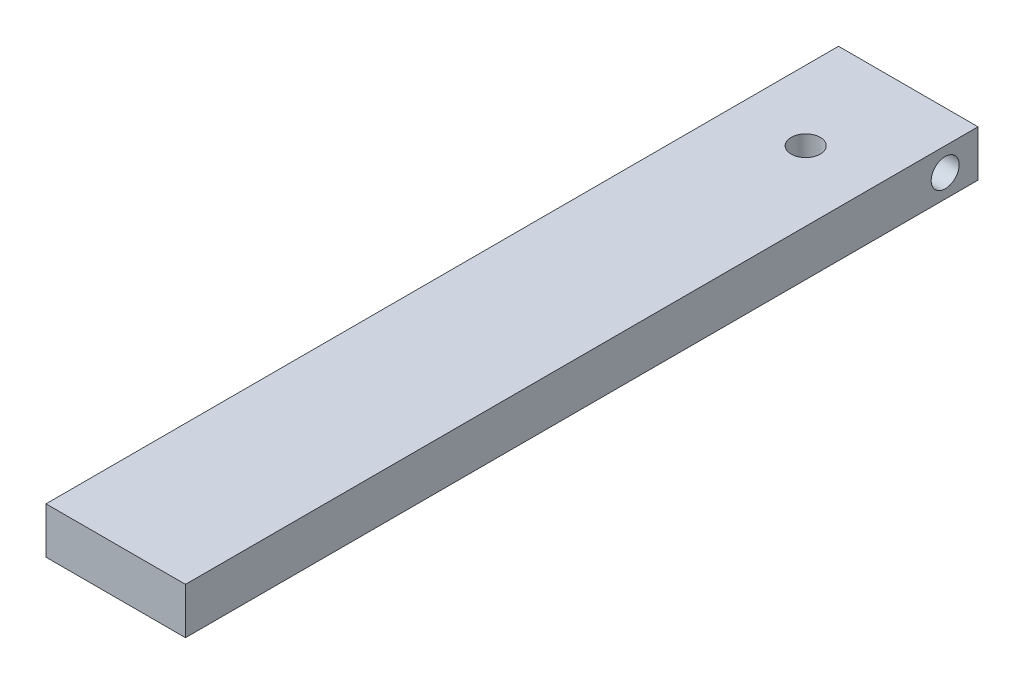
SolidWorks part; units mm, degrees
ref_plane "Plane1" through (0, 0, 0) normal (0, 0, 1) x (1, 0, 0)
ref_plane "Plane2" through (0, 0, 0) normal (0, 1, 0) x (1, 0, 0)
ref_plane "Plane3" through (0, 0, 0) normal (1, 0, 0) x (0, 0, -1)
sketch "Sketch1" plane through (0, 0, 0) normal (0, 0, 1) x (1, 0, 0)
  line L0 (-9.4996, 0) -> (9.4996, 0)
  line L1 (-9.4996, 0) -> (-9.4996, -6.2992)
  line L2 (9.4996, -6.2992) -> (-9.4996, -6.2992)
  line L3 (9.4996, -6.2992) -> (9.4996, 0)
  dimension "D1" = 18.9992
  dimension "D2" = 6.2992
extrude "Base-Extrude" add sketch "Sketch1" along normal blind 107.95
sketch "Sketch2" plane through (0, 0, 0) normal (0, 1, 0) x (-1, 0, 0)
  line L0 (0, -7.9589) -> (0, 120.2319) construction
  circle A0 centre (0, 13.97) radius 1.9812
  dimension "D1" = 3.9624
  dimension "D2" = 13.97
extrude "Cut-Extrude1" cut sketch "Sketch2" against normal through all
sketch "Sketch3" plane through (9.4996, 0, 0) normal (1, 0, 0) x (0, 0, -1)
  line L0 (0, -6.2992) -> (0, 0) construction
  line L1 (-107.95, 0) -> (0, 0) construction
  circle A0 centre (-4.4704, -3.175) radius 1.905
  dimension "D1" = 3.81
  dimension "D2" = 4.4704
  dimension "D3" = 3.175
extrude "Cut-Extrude2" cut sketch "Sketch3" against normal through all
sketch "Sketch4" plane through (0, 0, 0) normal (0, 0, -1) x (-1, 0, 0)
  line L0 (0, -15.1707) -> (0, -15.2292) construction
  line L1 (0, 0) -> (0, -19.3457) construction
  line L2 (9.4996, 0) -> (-9.4996, 0) construction
  circle A0 centre (0, -3.175) radius 2.3749
  dimension "D1" = 4.7498
  dimension "D2" = 3.175
extrude "Cut-Extrude3" cut sketch "Sketch4" against normal blind 9.525
